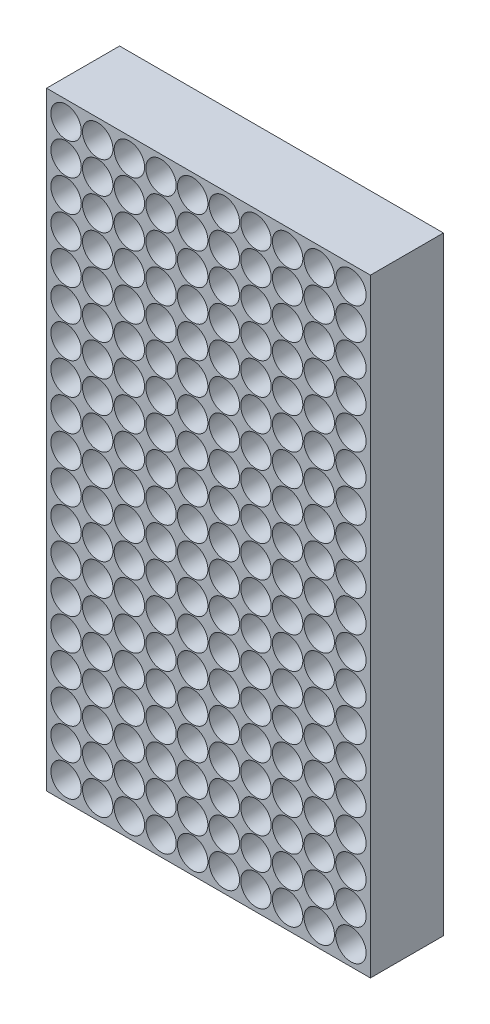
SolidWorks part; units mm, degrees
ref_plane "Ön Düzlem" through (0, 0, 0) normal (0, 0, 1) x (1, 0, 0)
ref_plane "Üst Düzlem" through (0, 0, 0) normal (0, 1, 0) x (1, 0, 0)
ref_plane "Sağ Düzlem" through (0, 0, 0) normal (1, 0, 0) x (0, 0, -1)
sketch "Çizim1" plane through (0, 0, 0) normal (0, 0, 1) x (1, 0, 0)
  line L1 (-266, -500) -> (266, -500)
  line L2 (-266, -500) -> (-266, 500)
  line L3 (-266, 500) -> (266, 500)
  line L4 (266, -500) -> (266, 500)
  line L5 (-266, -500) -> (266, 500) construction
  line L6 (-266, 500) -> (266, -500) construction
  point P0 (0, 0)
  dimension "D1" = 1000
  dimension "D2" = 532
extrude "Yükseklik-Ekstrüzyon1" add sketch "Çizim1" against normal blind 121
sketch "Çizim2" plane through (0, 0, 0) normal (0, 0, 1) x (1, 0, 0)
  line L0 (-266, 500) -> (-266, -500) construction
  line L1 (-266, -500) -> (266, -500) construction
  circle A0 centre (-234, -468) radius 25
  circle A1 centre (-182, -468) radius 25
  circle A2 centre (-130, -468) radius 25
  circle A3 centre (-78, -468) radius 25
  circle A4 centre (-26, -468) radius 25
  circle A5 centre (26, -468) radius 25
  circle A6 centre (78, -468) radius 25
  circle A7 centre (130, -468) radius 25
  circle A8 centre (182, -468) radius 25
  circle A9 centre (234, -468) radius 25
  circle A10 centre (-182, -416) radius 25
  circle A11 centre (-130, -416) radius 25
  circle A12 centre (-78, -416) radius 25
  circle A13 centre (-26, -416) radius 25
  circle A14 centre (26, -416) radius 25
  circle A15 centre (78, -416) radius 25
  circle A16 centre (130, -416) radius 25
  circle A17 centre (182, -416) radius 25
  circle A18 centre (234, -416) radius 25
  circle A19 centre (-182, -364) radius 25
  circle A20 centre (-130, -364) radius 25
  circle A21 centre (-78, -364) radius 25
  circle A22 centre (-26, -364) radius 25
  circle A23 centre (26, -364) radius 25
  circle A24 centre (78, -364) radius 25
  circle A25 centre (130, -364) radius 25
  circle A26 centre (182, -364) radius 25
  circle A27 centre (234, -364) radius 25
  circle A28 centre (-182, -312) radius 25
  circle A29 centre (-130, -312) radius 25
  circle A30 centre (-78, -312) radius 25
  circle A31 centre (-26, -312) radius 25
  circle A32 centre (26, -312) radius 25
  circle A33 centre (78, -312) radius 25
  circle A34 centre (130, -312) radius 25
  circle A35 centre (182, -312) radius 25
  circle A36 centre (234, -312) radius 25
  circle A37 centre (-182, -260) radius 25
  circle A38 centre (-130, -260) radius 25
  circle A39 centre (-78, -260) radius 25
  circle A40 centre (-26, -260) radius 25
  circle A41 centre (26, -260) radius 25
  circle A42 centre (78, -260) radius 25
  circle A43 centre (130, -260) radius 25
  circle A44 centre (182, -260) radius 25
  circle A45 centre (234, -260) radius 25
  circle A46 centre (-182, -208) radius 25
  circle A47 centre (-130, -208) radius 25
  circle A48 centre (-78, -208) radius 25
  circle A49 centre (-26, -208) radius 25
  circle A50 centre (26, -208) radius 25
  circle A51 centre (78, -208) radius 25
  circle A52 centre (130, -208) radius 25
  circle A53 centre (182, -208) radius 25
  circle A54 centre (234, -208) radius 25
  circle A55 centre (-182, -156) radius 25
  circle A56 centre (-130, -156) radius 25
  circle A57 centre (-78, -156) radius 25
  circle A58 centre (-26, -156) radius 25
  circle A59 centre (26, -156) radius 25
  circle A60 centre (78, -156) radius 25
  circle A61 centre (130, -156) radius 25
  circle A62 centre (182, -156) radius 25
  circle A63 centre (234, -156) radius 25
  circle A64 centre (-182, -104) radius 25
  circle A65 centre (-130, -104) radius 25
  circle A66 centre (-78, -104) radius 25
  circle A67 centre (-26, -104) radius 25
  circle A68 centre (26, -104) radius 25
  circle A69 centre (78, -104) radius 25
  circle A70 centre (130, -104) radius 25
  circle A71 centre (182, -104) radius 25
  circle A72 centre (234, -104) radius 25
  circle A73 centre (-182, -52) radius 25
  circle A74 centre (-130, -52) radius 25
  circle A75 centre (-78, -52) radius 25
  circle A76 centre (-26, -52) radius 25
  circle A77 centre (26, -52) radius 25
  circle A78 centre (78, -52) radius 25
  circle A79 centre (130, -52) radius 25
  circle A80 centre (182, -52) radius 25
  circle A81 centre (234, -52) radius 25
  circle A82 centre (-182, 0) radius 25
  circle A83 centre (-130, 0) radius 25
  circle A84 centre (-78, 0) radius 25
  circle A85 centre (-26, 0) radius 25
  circle A86 centre (26, 0) radius 25
  circle A87 centre (78, 0) radius 25
  circle A88 centre (130, 0) radius 25
  circle A89 centre (182, 0) radius 25
  circle A90 centre (234, 0) radius 25
  circle A91 centre (-182, 52) radius 25
  circle A92 centre (-130, 52) radius 25
  circle A93 centre (-78, 52) radius 25
  circle A94 centre (-26, 52) radius 25
  circle A95 centre (26, 52) radius 25
  circle A96 centre (78, 52) radius 25
  circle A97 centre (130, 52) radius 25
  circle A98 centre (182, 52) radius 25
  circle A99 centre (234, 52) radius 25
  circle A100 centre (-182, 104) radius 25
  circle A101 centre (-130, 104) radius 25
  circle A102 centre (-78, 104) radius 25
  circle A103 centre (-26, 104) radius 25
  circle A104 centre (26, 104) radius 25
  circle A105 centre (78, 104) radius 25
  circle A106 centre (130, 104) radius 25
  circle A107 centre (182, 104) radius 25
  circle A108 centre (234, 104) radius 25
  circle A109 centre (-182, 156) radius 25
  circle A110 centre (-130, 156) radius 25
  circle A111 centre (-78, 156) radius 25
  circle A112 centre (-26, 156) radius 25
  circle A113 centre (26, 156) radius 25
  circle A114 centre (78, 156) radius 25
  circle A115 centre (130, 156) radius 25
  circle A116 centre (182, 156) radius 25
  circle A117 centre (234, 156) radius 25
  circle A118 centre (-182, 208) radius 25
  circle A119 centre (-130, 208) radius 25
  circle A120 centre (-78, 208) radius 25
  circle A121 centre (-26, 208) radius 25
  circle A122 centre (26, 208) radius 25
  circle A123 centre (78, 208) radius 25
  circle A124 centre (130, 208) radius 25
  circle A125 centre (182, 208) radius 25
  circle A126 centre (234, 208) radius 25
  circle A127 centre (-182, 260) radius 25
  circle A128 centre (-130, 260) radius 25
  circle A129 centre (-78, 260) radius 25
  circle A130 centre (-26, 260) radius 25
  circle A131 centre (26, 260) radius 25
  circle A132 centre (78, 260) radius 25
  circle A133 centre (130, 260) radius 25
  circle A134 centre (182, 260) radius 25
  circle A135 centre (234, 260) radius 25
  circle A136 centre (-182, 312) radius 25
  circle A137 centre (-130, 312) radius 25
  circle A138 centre (-78, 312) radius 25
  circle A139 centre (-26, 312) radius 25
  circle A140 centre (26, 312) radius 25
  circle A141 centre (78, 312) radius 25
  circle A142 centre (130, 312) radius 25
  circle A143 centre (182, 312) radius 25
  circle A144 centre (234, 312) radius 25
  circle A145 centre (-182, 364) radius 25
  circle A146 centre (-130, 364) radius 25
  circle A147 centre (-78, 364) radius 25
  circle A148 centre (-26, 364) radius 25
  circle A149 centre (26, 364) radius 25
  circle A150 centre (78, 364) radius 25
  circle A151 centre (130, 364) radius 25
  circle A152 centre (182, 364) radius 25
  circle A153 centre (234, 364) radius 25
  circle A154 centre (-182, 416) radius 25
  circle A155 centre (-130, 416) radius 25
  circle A156 centre (-78, 416) radius 25
  circle A157 centre (-26, 416) radius 25
  circle A158 centre (26, 416) radius 25
  circle A159 centre (78, 416) radius 25
  circle A160 centre (130, 416) radius 25
  circle A161 centre (182, 416) radius 25
  circle A162 centre (234, 416) radius 25
  circle A163 centre (-182, 468) radius 25
  circle A164 centre (-130, 468) radius 25
  circle A165 centre (-78, 468) radius 25
  circle A166 centre (-26, 468) radius 25
  circle A167 centre (26, 468) radius 25
  circle A168 centre (78, 468) radius 25
  circle A169 centre (130, 468) radius 25
  circle A170 centre (182, 468) radius 25
  circle A171 centre (234, 468) radius 25
  circle A172 centre (-234, -416) radius 25
  circle A173 centre (-234, -364) radius 25
  circle A174 centre (-234, -312) radius 25
  circle A175 centre (-234, -260) radius 25
  circle A176 centre (-234, -208) radius 25
  circle A177 centre (-234, -156) radius 25
  circle A178 centre (-234, -104) radius 25
  circle A179 centre (-234, -52) radius 25
  circle A180 centre (-234, 0) radius 25
  circle A181 centre (-234, 52) radius 25
  circle A182 centre (-234, 104) radius 25
  circle A183 centre (-234, 156) radius 25
  circle A184 centre (-234, 208) radius 25
  circle A185 centre (-234, 260) radius 25
  circle A186 centre (-234, 312) radius 25
  circle A187 centre (-234, 364) radius 25
  circle A188 centre (-234, 416) radius 25
  circle A189 centre (-234, 468) radius 25
  dimension "D1" = 50
  dimension "D2" = 32
  dimension "D3" = 32
  dimension "D4" = 10
extrude "Kes-Ekstrüzyon1" cut sketch "Çizim2" against normal blind 118.5
shell "İç Boşaltma1" thickness 1.5
sketch "Çizim3" plane through (0, 0, -121) normal (0, 0, -1) x (-1, 0, 0)
  line L0 (-259, -493) -> (259, -493)
  line L1 (259, -493) -> (259, 493)
  line L2 (259, 493) -> (-259, 493)
  line L3 (-259, 493) -> (-259, -493)
  line L4 (-266, 500) -> (-266, -500)
  line L5 (-266, -500) -> (266, -500)
  line L6 (266, -500) -> (266, 500)
  line L7 (266, 500) -> (-266, 500)
  line L8 (-266, 500) -> (-266, -500)
  line L9 (-266, -500) -> (266, -500)
  line L10 (266, -500) -> (266, 500)
  line L11 (266, 500) -> (-266, 500)
  dimension "D1" = 0
  dimension "D2" = 7
extrude "Yükseklik-Ekstrüzyon3" add sketch "Çizim3" against normal blind 120
sketch "Çizim5" plane through (0, 500, 0) normal (0, 1, 0) x (1, 0, 0)
  line L0 (266, 121) -> (266, 0) construction
  line L1 (-266, 121) -> (266, 121)
  line L2 (-266, 121) -> (-266, 120)
  line L3 (-266, 120) -> (266, 120)
  line L4 (266, 121) -> (266, 120)
  dimension "D1" = 1
extrude "Kes-Ekstrüzyon2" cut sketch "Çizim5" against normal through all
sketch "Çizim6" plane through (0, 0, -120) normal (0, 0, -1) x (-1, 0, 0)
  circle A0 centre (-234, -468) radius 5
  circle A1 centre (-182, -468) radius 5
  circle A2 centre (-130, -468) radius 5
  circle A3 centre (-78, -468) radius 5
  circle A4 centre (-26, -468) radius 5
  circle A5 centre (26, -468) radius 5
  circle A6 centre (78, -468) radius 5
  circle A7 centre (130, -468) radius 5
  circle A8 centre (182, -468) radius 5
  circle A9 centre (234, -468) radius 5
  circle A10 centre (-182, -416) radius 5
  circle A11 centre (-130, -416) radius 5
  circle A12 centre (-78, -416) radius 5
  circle A13 centre (-26, -416) radius 5
  circle A14 centre (26, -416) radius 5
  circle A15 centre (78, -416) radius 5
  circle A16 centre (130, -416) radius 5
  circle A17 centre (182, -416) radius 5
  circle A18 centre (234, -416) radius 5
  circle A19 centre (-182, -364) radius 5
  circle A20 centre (-130, -364) radius 5
  circle A21 centre (-78, -364) radius 5
  circle A22 centre (-26, -364) radius 5
  circle A23 centre (26, -364) radius 5
  circle A24 centre (78, -364) radius 5
  circle A25 centre (130, -364) radius 5
  circle A26 centre (182, -364) radius 5
  circle A27 centre (234, -364) radius 5
  circle A28 centre (-182, -312) radius 5
  circle A29 centre (-130, -312) radius 5
  circle A30 centre (-78, -312) radius 5
  circle A31 centre (-26, -312) radius 5
  circle A32 centre (26, -312) radius 5
  circle A33 centre (78, -312) radius 5
  circle A34 centre (130, -312) radius 5
  circle A35 centre (182, -312) radius 5
  circle A36 centre (234, -312) radius 5
  circle A37 centre (-182, -260) radius 5
  circle A38 centre (-130, -260) radius 5
  circle A39 centre (-78, -260) radius 5
  circle A40 centre (-26, -260) radius 5
  circle A41 centre (26, -260) radius 5
  circle A42 centre (78, -260) radius 5
  circle A43 centre (130, -260) radius 5
  circle A44 centre (182, -260) radius 5
  circle A45 centre (234, -260) radius 5
  circle A46 centre (-182, -208) radius 5
  circle A47 centre (-130, -208) radius 5
  circle A48 centre (-78, -208) radius 5
  circle A49 centre (-26, -208) radius 5
  circle A50 centre (26, -208) radius 5
  circle A51 centre (78, -208) radius 5
  circle A52 centre (130, -208) radius 5
  circle A53 centre (182, -208) radius 5
  circle A54 centre (234, -208) radius 5
  circle A55 centre (-182, -156) radius 5
  circle A56 centre (-130, -156) radius 5
  circle A57 centre (-78, -156) radius 5
  circle A58 centre (-26, -156) radius 5
  circle A59 centre (26, -156) radius 5
  circle A60 centre (78, -156) radius 5
  circle A61 centre (130, -156) radius 5
  circle A62 centre (182, -156) radius 5
  circle A63 centre (234, -156) radius 5
  circle A64 centre (-182, -104) radius 5
  circle A65 centre (-130, -104) radius 5
  circle A66 centre (-78, -104) radius 5
  circle A67 centre (-26, -104) radius 5
  circle A68 centre (26, -104) radius 5
  circle A69 centre (78, -104) radius 5
  circle A70 centre (130, -104) radius 5
  circle A71 centre (182, -104) radius 5
  circle A72 centre (234, -104) radius 5
  circle A73 centre (-182, -52) radius 5
  circle A74 centre (-130, -52) radius 5
  circle A75 centre (-78, -52) radius 5
  circle A76 centre (-26, -52) radius 5
  circle A77 centre (26, -52) radius 5
  circle A78 centre (78, -52) radius 5
  circle A79 centre (130, -52) radius 5
  circle A80 centre (182, -52) radius 5
  circle A81 centre (234, -52) radius 5
  circle A82 centre (-182, 0) radius 5
  circle A83 centre (-130, 0) radius 5
  circle A84 centre (-78, 0) radius 5
  circle A85 centre (-26, 0) radius 5
  circle A86 centre (26, 0) radius 5
  circle A87 centre (78, 0) radius 5
  circle A88 centre (130, 0) radius 5
  circle A89 centre (182, 0) radius 5
  circle A90 centre (234, 0) radius 5
  circle A91 centre (-182, 52) radius 5
  circle A92 centre (-130, 52) radius 5
  circle A93 centre (-78, 52) radius 5
  circle A94 centre (-26, 52) radius 5
  circle A95 centre (26, 52) radius 5
  circle A96 centre (78, 52) radius 5
  circle A97 centre (130, 52) radius 5
  circle A98 centre (182, 52) radius 5
  circle A99 centre (234, 52) radius 5
  circle A100 centre (-182, 104) radius 5
  circle A101 centre (-130, 104) radius 5
  circle A102 centre (-78, 104) radius 5
  circle A103 centre (-26, 104) radius 5
  circle A104 centre (26, 104) radius 5
  circle A105 centre (78, 104) radius 5
  circle A106 centre (130, 104) radius 5
  circle A107 centre (182, 104) radius 5
  circle A108 centre (234, 104) radius 5
  circle A109 centre (-182, 156) radius 5
  circle A110 centre (-130, 156) radius 5
  circle A111 centre (-78, 156) radius 5
  circle A112 centre (-26, 156) radius 5
  circle A113 centre (26, 156) radius 5
  circle A114 centre (78, 156) radius 5
  circle A115 centre (130, 156) radius 5
  circle A116 centre (182, 156) radius 5
  circle A117 centre (234, 156) radius 5
  circle A118 centre (-182, 208) radius 5
  circle A119 centre (-130, 208) radius 5
  circle A120 centre (-78, 208) radius 5
  circle A121 centre (-26, 208) radius 5
  circle A122 centre (26, 208) radius 5
  circle A123 centre (78, 208) radius 5
  circle A124 centre (130, 208) radius 5
  circle A125 centre (182, 208) radius 5
  circle A126 centre (234, 208) radius 5
  circle A127 centre (-182, 260) radius 5
  circle A128 centre (-130, 260) radius 5
  circle A129 centre (-78, 260) radius 5
  circle A130 centre (-26, 260) radius 5
  circle A131 centre (26, 260) radius 5
  circle A132 centre (78, 260) radius 5
  circle A133 centre (130, 260) radius 5
  circle A134 centre (182, 260) radius 5
  circle A135 centre (234, 260) radius 5
  circle A136 centre (-182, 312) radius 5
  circle A137 centre (-130, 312) radius 5
  circle A138 centre (-78, 312) radius 5
  circle A139 centre (-26, 312) radius 5
  circle A140 centre (26, 312) radius 5
  circle A141 centre (78, 312) radius 5
  circle A142 centre (130, 312) radius 5
  circle A143 centre (182, 312) radius 5
  circle A144 centre (234, 312) radius 5
  circle A145 centre (-182, 364) radius 5
  circle A146 centre (-130, 364) radius 5
  circle A147 centre (-78, 364) radius 5
  circle A148 centre (-26, 364) radius 5
  circle A149 centre (26, 364) radius 5
  circle A150 centre (78, 364) radius 5
  circle A151 centre (130, 364) radius 5
  circle A152 centre (182, 364) radius 5
  circle A153 centre (234, 364) radius 5
  circle A154 centre (-182, 416) radius 5
  circle A155 centre (-130, 416) radius 5
  circle A156 centre (-78, 416) radius 5
  circle A157 centre (-26, 416) radius 5
  circle A158 centre (26, 416) radius 5
  circle A159 centre (78, 416) radius 5
  circle A160 centre (130, 416) radius 5
  circle A161 centre (182, 416) radius 5
  circle A162 centre (234, 416) radius 5
  circle A163 centre (-182, 468) radius 5
  circle A164 centre (-130, 468) radius 5
  circle A165 centre (-78, 468) radius 5
  circle A166 centre (-26, 468) radius 5
  circle A167 centre (26, 468) radius 5
  circle A168 centre (78, 468) radius 5
  circle A169 centre (130, 468) radius 5
  circle A170 centre (182, 468) radius 5
  circle A171 centre (234, 468) radius 5
  circle A172 centre (-234, -416) radius 5
  circle A173 centre (-234, -364) radius 5
  circle A174 centre (-234, -312) radius 5
  circle A175 centre (-234, -260) radius 5
  circle A176 centre (-234, -208) radius 5
  circle A177 centre (-234, -156) radius 5
  circle A178 centre (-234, -104) radius 5
  circle A179 centre (-234, -52) radius 5
  circle A180 centre (-234, 0) radius 5
  circle A181 centre (-234, 52) radius 5
  circle A182 centre (-234, 104) radius 5
  circle A183 centre (-234, 156) radius 5
  circle A184 centre (-234, 208) radius 5
  circle A185 centre (-234, 260) radius 5
  circle A186 centre (-234, 312) radius 5
  circle A187 centre (-234, 364) radius 5
  circle A188 centre (-234, 416) radius 5
  circle A189 centre (-234, 468) radius 5
  dimension "D1" = 10
  dimension "D2" = 10
extrude "Kes-Ekstrüzyon3" cut sketch "Çizim6" against normal blind 120
